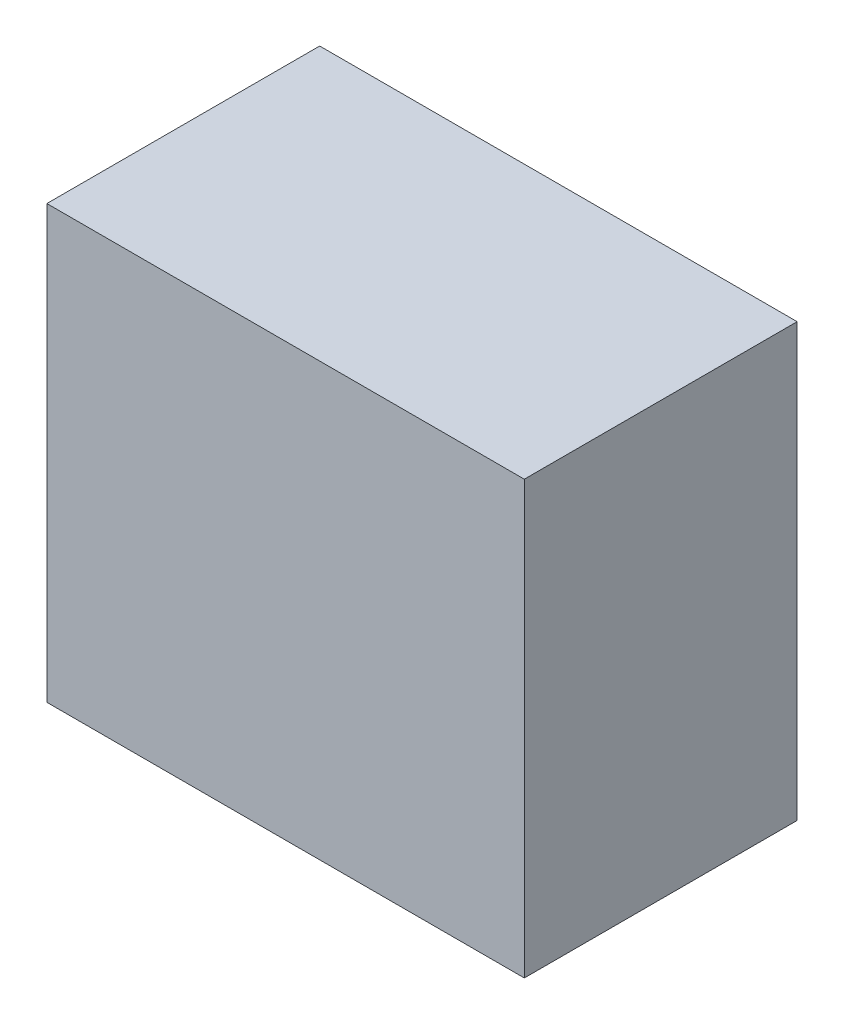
SolidWorks part; units mm, degrees
ref_plane "Plan de face" through (0, 0, 0) normal (0, 0, 1) x (1, 0, 0)
ref_plane "Plan de dessus" through (0, 0, 0) normal (0, 1, 0) x (1, 0, 0)
ref_plane "Plan de droite" through (0, 0, 0) normal (1, 0, 0) x (0, 0, -1)
sketch "Esquisse1" plane through (0, 0, 0) normal (0, 0, 1) x (1, 0, 0)
  line L1 (0, 0) -> (105, 0)
  line L2 (0, 0) -> (0, 95)
  line L3 (0, 95) -> (105, 95)
  line L4 (105, 0) -> (105, 95)
  dimension "D1" = 95
  dimension "D2" = 105
extrude "Boss.-Extru.1" add sketch "Esquisse1" along normal blind 60
